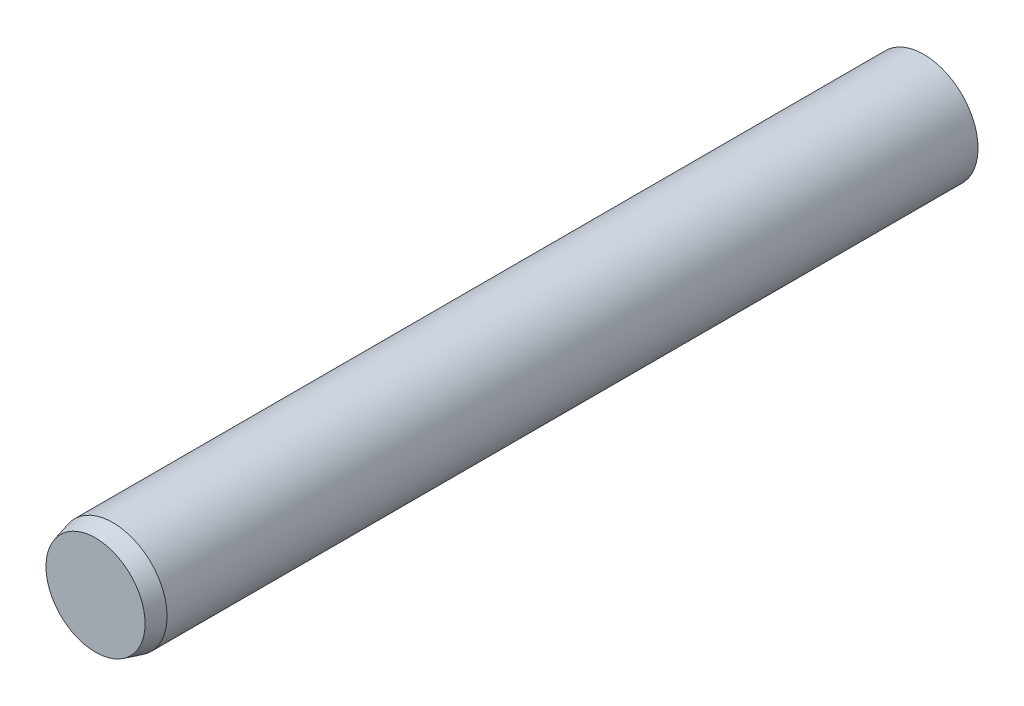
SolidWorks part; units mm, degrees
ref_plane "Front Plane" through (0, 0, 0) normal (0, 0, 1) x (1, 0, 0)
ref_plane "Top Plane" through (0, 0, 0) normal (0, 1, 0) x (1, 0, 0)
ref_plane "Right Plane" through (0, 0, 0) normal (1, 0, 0) x (0, 0, -1)
sketch "Sketch1" plane through (0, 0, 0) normal (0, 0, 1) x (1, 0, 0)
  ellipse E0 centre (0, 0) end of major axis (-1.9844, 0) minor radius 1.9842 (1.9844, 0) -> (-1.9844, 0) ccw
  ellipse E1 centre (0, 0) end of major axis (-1.9844, 0) minor radius 1.9842 (-1.9844, 0) -> (1.9844, 0) ccw
extrude "Boss-Extrude2" add sketch "Sketch1" along normal mid plane 30.5
chamfer "Chamfer1" distance 0.635 angle 15 2 edges at (-1.9844, 0, -15.25) (-1.9844, 0, 15.25)
